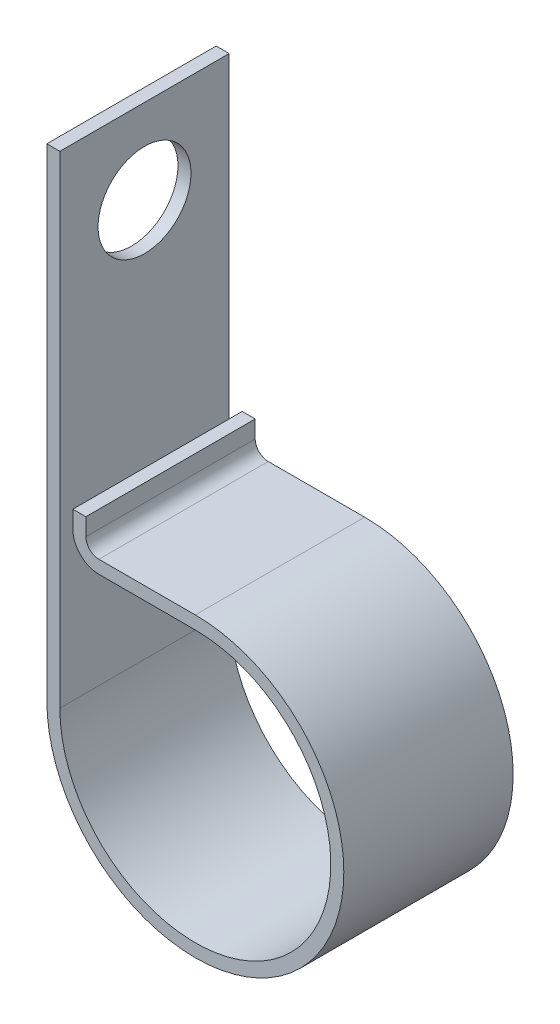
SolidWorks part; units mm, degrees
ref_plane "Front Plane" through (0, 0, 0) normal (0, 0, 1) x (1, 0, 0)
ref_plane "Top Plane" through (0, 0, 0) normal (0, 1, 0) x (1, 0, 0)
ref_plane "Right Plane" through (0, 0, 0) normal (1, 0, 0) x (0, 0, -1)
sketch "Sketch1" plane through (0, 0, 0) normal (0, 0, 1) x (1, 0, 0)
  line L0 (0, -37.2872) -> (0, 7.9248)
  line L1 (1.2192, -20.5232) -> (1.2192, -22.1488)
  line L2 (12.7, -24.5872) -> (3.6576, -24.5872)
  arc A0 (0, -37.2872) -> (12.7, -24.5872) centre (12.7, -37.2872) ccw
  arc A1 (3.6576, -24.5872) -> (1.2192, -22.1488) centre (3.6576, -22.1488) cw
  dimension "D Clamping Diameter" = 25.4
  dimension "OR Outside Radius" = 2.4384
  dimension "L Center to Center" = 37.2872
  dimension "D3" = 4.064
  dimension "G Gap" = 1.2192
  dimension "E Hole Center to End" = 7.9248
extrude "Extrude-Thin5" add sketch "Sketch1" along normal mid plane 15.875 thin
hole_wizard "13/32 (0.40625) Diameter Hole1" positions "Sketch3" profile "Sketch2" hole size "13/32" standard "ANSI Inch"
sketch "Sketch3" plane through (0, 0, 0) normal (1, 0, 0) x (0, 0, -1)
  line L0 (-7.9375, 7.9248) -> (7.9375, 7.9248) construction
  line L1 (-7.9375, -37.2872) -> (-7.9375, 7.9248) construction
  point P0 (0, 0)
  dimension "D1" = 7.9248
  dimension "D2" = 7.9375
sketch "Sketch2" plane through (0, 0, 0) normal (0, 1, 0) x (0, 0, -1)
  line L0 (0, 0) -> (0, 1.2192)
  line L1 (0, 1.2192) -> (4.3561, 1.2192)
  line L2 (4.3561, 1.2192) -> (4.3561, 0)
  line L5 (4.3561, 0) -> (0, 0)
  line L11 (0, -6.35) -> (0, 107.95) construction
  dimension "H Hole Diameter" = 8.7122
  dimension "Thru Hole Depth" = 1.2192
